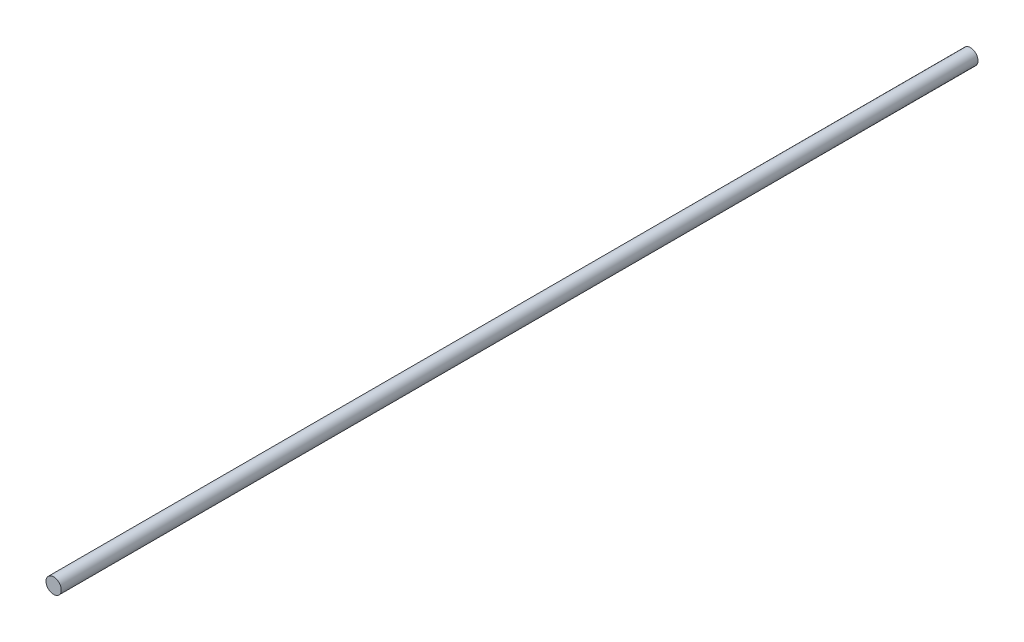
SolidWorks part; units mm, degrees
ref_plane "Front Plane" through (0, 0, 0) normal (0, 0, 1) x (1, 0, 0)
ref_plane "Top Plane" through (0, 0, 0) normal (0, 1, 0) x (1, 0, 0)
ref_plane "Right Plane" through (0, 0, 0) normal (1, 0, 0) x (0, 0, -1)
sketch "Sketch1" plane through (0, 0, 0) normal (0, 0, 1) x (1, 0, 0)
  circle A0 centre (-5.3725, 4.7481) radius 1.9812
  dimension "D1" = 3.9624
extrude "Boss-Extrude1" add sketch "Sketch1" along normal blind 238.125
